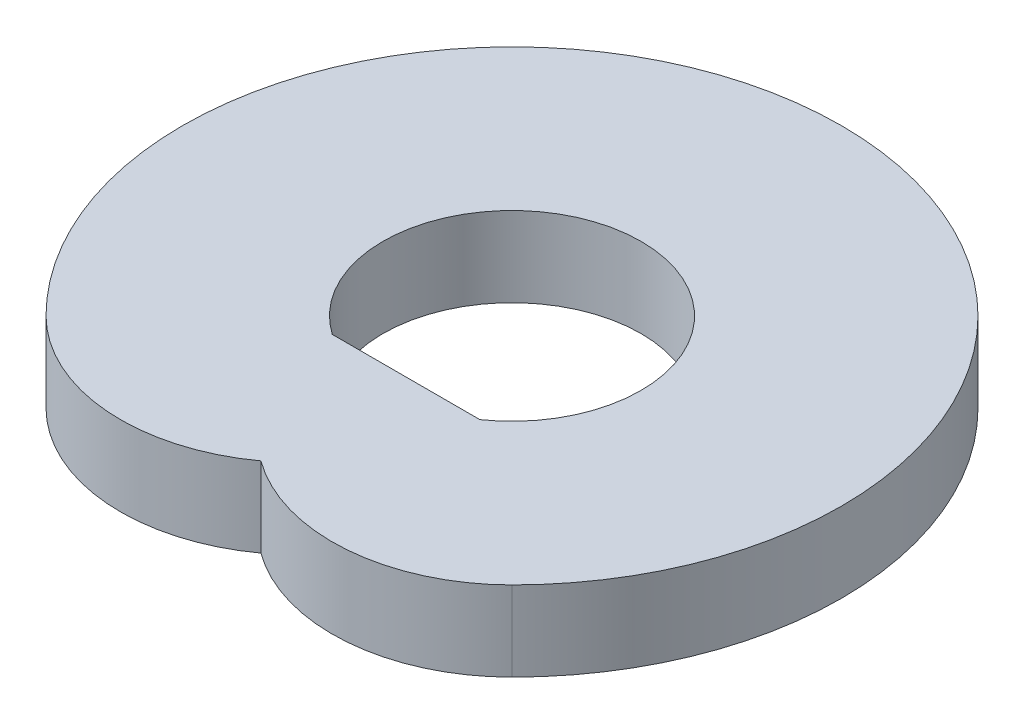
SolidWorks part; units mm, degrees
ref_plane "前视基准面" through (0, 0, 0) normal (0, 0, 1) x (1, 0, 0)
ref_plane "上视基准面" through (0, 0, 0) normal (0, 1, 0) x (1, 0, 0)
ref_plane "右视基准面" through (0, 0, 0) normal (1, 0, 0) x (0, 0, -1)
sketch "草图1" plane through (0, 0, 0) normal (0, 1, 0) x (1, 0, 0)
  line L0 (0, 0) -> (0, 825) construction
  line L1 (0, 0) -> (-583.3631, -583.3631) construction
  line L2 (0, 0) -> (583.3631, -583.3631) construction
  line L3 (0, 375) -> (318.1981, 56.8019) construction
  line L4 (0, 375) -> (-318.1981, 56.8019) construction
  line L6 (184.835, -265.165) -> (-184.835, -265.165)
  circle A0 centre (0, 0) radius 375 construction
  circle A1 centre (0, 375) radius 450 construction
  arc A2 (583.3631, -583.3631) -> (-583.3631, -583.3631) centre (0, 0) ccw
  arc A4 (-583.3631, -583.3631) -> (0, -628.741) centre (-265.165, -265.165) ccw
  arc A5 (0, -628.741) -> (583.3631, -583.3631) centre (265.165, -265.165) ccw
  arc A7 (184.835, -265.165) -> (-184.835, -265.165) centre (0, 0) ccw
  dimension "D1" = 750
  dimension "D2" = 900
  dimension "D4" = 135
  dimension "D3" = 825
  dimension "D8" = 135
  dimension "D5" = 135
  dimension "D6" = 135
  dimension "D7" = 135
extrude "凸台-拉伸1" add sketch "草图1" along normal blind 200
